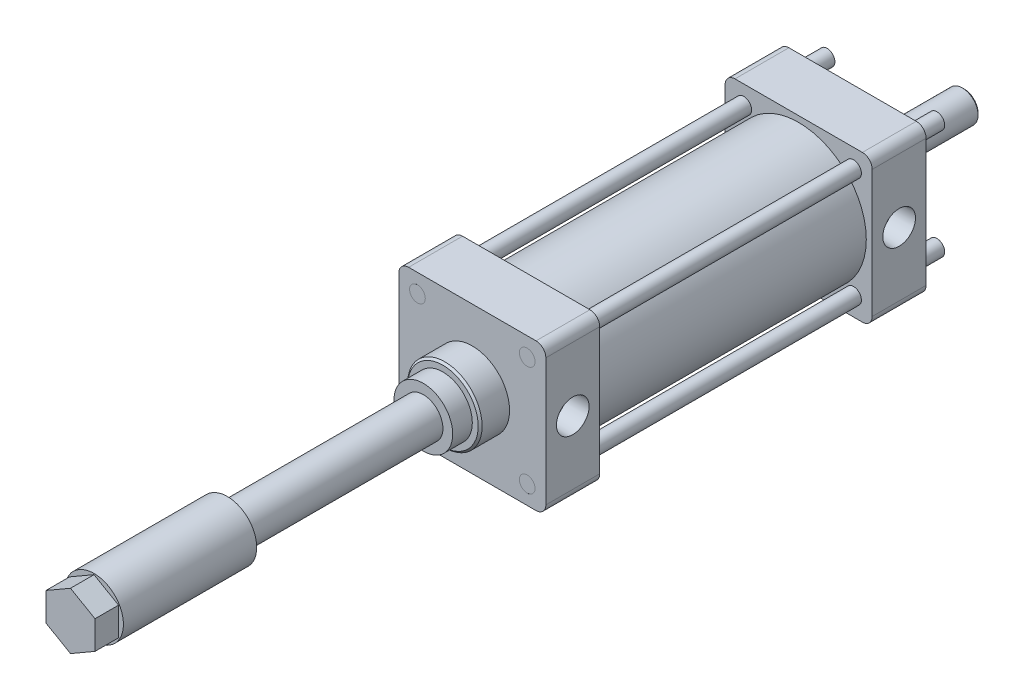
SolidWorks part; units mm, degrees
ref_plane "前视基准面" through (0, 0, 0) normal (0, 0, 1) x (1, 0, 0)
ref_plane "上视基准面" through (0, 0, 0) normal (0, 1, 0) x (1, 0, 0)
ref_plane "右视基准面" through (0, 0, 0) normal (1, 0, 0) x (0, 0, -1)
sketch "草图1" plane through (0, 0, 0) normal (0, 0, 1) x (1, 0, 0)
  line L0 (0, 0) -> (28, 0) construction
  line L1 (32.5, 37.5) -> (-32.5, 37.5)
  line L2 (37.5, 32.5) -> (37.5, -32.5)
  line L3 (32.5, -37.5) -> (-32.5, -37.5)
  line L4 (-37.5, 32.5) -> (-37.5, -32.5)
  line L5 (37.5, 37.5) -> (-37.5, -37.5) construction
  line L6 (37.5, -37.5) -> (-37.5, 37.5) construction
  line L7 (28, 0) -> (28, -28) construction
  arc A0 (-37.5, -32.5) -> (-32.5, -37.5) centre (-32.5, -32.5) ccw
  arc A1 (37.5, -32.5) -> (32.5, -37.5) centre (32.5, -32.5) cw
  arc A2 (32.5, 37.5) -> (37.5, 32.5) centre (32.5, 32.5) cw
  arc A3 (-37.5, 32.5) -> (-32.5, 37.5) centre (-32.5, 32.5) cw
  circle A4 centre (28, -28) radius 4
  circle A5 centre (-28, -28) radius 4
  circle A6 centre (-28, 28) radius 4
  circle A7 centre (28, 28) radius 4
  point P0 (0, 0)
  point P31 (0, 0)
  dimension "D3" = 5
  dimension "D4" = 4
  dimension "D1" = 75
  dimension "D2" = 75
extrude "凸台-拉伸1" add sketch "草图1" along normal blind 27.5
sketch "草图2" plane through (0, 0, 0) normal (0, 0, -1) x (-1, 0, 0)
  circle A0 centre (0, 0) radius 19
extrude "凸台-拉伸2" add sketch "草图2" along normal blind 15
sketch "草图3" plane through (0, 0, -15) normal (0, 0, -1) x (-1, 0, 0)
  circle A0 centre (0, 0) radius 10
extrude "凸台-拉伸3" add sketch "草图3" along normal blind 10
sketch "草图4" plane through (0, 0, -25) normal (0, 0, -1) x (-1, 0, 0)
  circle A0 centre (0, 0) radius 8
extrude "凸台-拉伸4" add sketch "草图4" along normal blind 32
chamfer "倒角1" distance 1 angle 45 3 edges at (-8, 0, -57) (-19, 0, -15) (-10, 0, -25)
sketch "草图5" plane through (0, 0, 27.5) normal (0, 0, 1) x (1, 0, 0)
  circle A0 centre (0, 0) radius 34.5
extrude "凸台-拉伸5" add sketch "草图5" along normal blind 139
sketch "草图6" plane through (0, 0, 166.5) normal (0, 0, 1) x (1, 0, 0)
  line L0 (-37.5, 32.5) -> (-37.5, -32.5) construction
  line L1 (-32.5, -37.5) -> (32.5, -37.5) construction
  line L2 (32.5, 37.5) -> (-32.5, 37.5) construction
  line L3 (37.5, -32.5) -> (37.5, 32.5) construction
  line L4 (-37.5, 32.5) -> (-37.5, -32.5)
  line L5 (-32.5, -37.5) -> (32.5, -37.5)
  line L6 (32.5, 37.5) -> (-32.5, 37.5)
  line L7 (37.5, -32.5) -> (37.5, 32.5)
  circle A0 centre (-28, 28) radius 4 construction
  arc A1 (-32.5, 37.5) -> (-37.5, 32.5) centre (-32.5, 32.5) ccw construction
  circle A2 centre (-28, -28) radius 4 construction
  arc A3 (-37.5, -32.5) -> (-32.5, -37.5) centre (-32.5, -32.5) ccw construction
  arc A4 (32.5, -37.5) -> (37.5, -32.5) centre (32.5, -32.5) ccw construction
  circle A5 centre (28, -28) radius 4 construction
  circle A6 centre (28, 28) radius 4 construction
  arc A7 (37.5, 32.5) -> (32.5, 37.5) centre (32.5, 32.5) ccw construction
  circle A8 centre (-28, 28) radius 4
  arc A9 (-32.5, 37.5) -> (-37.5, 32.5) centre (-32.5, 32.5) ccw
  circle A10 centre (-28, -28) radius 4
  arc A11 (-37.5, -32.5) -> (-32.5, -37.5) centre (-32.5, -32.5) ccw
  arc A12 (32.5, -37.5) -> (37.5, -32.5) centre (32.5, -32.5) ccw
  circle A13 centre (28, -28) radius 4
  circle A14 centre (28, 28) radius 4
  arc A15 (37.5, 32.5) -> (32.5, 37.5) centre (32.5, 32.5) ccw
extrude "凸台-拉伸6" add sketch "草图6" along normal blind 27.5
sketch "草图7" plane through (0, 0, 194) normal (0, 0, 1) x (1, 0, 0)
  circle A0 centre (0, 0) radius 19
extrude "凸台-拉伸7" add sketch "草图7" along normal blind 15
chamfer "倒角2" distance 1 angle 45 1 edges at (19, 0, 209)
sketch "草图8" plane through (0, 0, 209) normal (0, 0, 1) x (1, 0, 0)
  circle A0 centre (0, 0) radius 15
extrude "凸台-拉伸8" add sketch "草图8" along normal blind 10
sketch "草图9" plane through (0, 0, 219) normal (0, 0, 1) x (1, 0, 0)
  circle A0 centre (0, 0) radius 10
extrude "凸台-拉伸9" add sketch "草图9" along normal blind 100
sketch "草图10" plane through (0, 0, 319) normal (0, 0, 1) x (1, 0, 0)
  circle A0 centre (0, 0) radius 15
extrude "凸台-拉伸10" add sketch "草图10" along normal blind 68
sketch "草图11" plane through (0, 0, 387) normal (0, 0, 1) x (1, 0, 0)
  line L1 (0, -14.4338) -> (12.5, -7.2169)
  line L2 (12.5, -7.2169) -> (12.5, 7.2169)
  line L3 (12.5, 7.2169) -> (0, 14.4338)
  line L4 (0, 14.4338) -> (-12.5, 7.2169)
  line L5 (-12.5, 7.2169) -> (-12.5, -7.2169)
  line L6 (-12.5, -7.2169) -> (0, -14.4338)
  circle A0 centre (0, 0) radius 12.5 construction
extrude "凸台-拉伸11" add sketch "草图11" along normal blind 12
sketch "草图12" plane through (0, 0, 0) normal (0, 0, -1) x (-1, 0, 0)
  circle A0 centre (-28, 28) radius 4 construction
  circle A1 centre (28, 28) radius 4 construction
  circle A2 centre (28, -28) radius 4 construction
  circle A3 centre (-28, -28) radius 4 construction
  circle A4 centre (-28, 28) radius 4
  circle A5 centre (28, 28) radius 4
  circle A6 centre (28, -28) radius 4
  circle A7 centre (-28, -28) radius 4
extrude "凸台-拉伸12" add sketch "草图12" along normal blind 15 and the other way up to surface (194 mm away) separate body
hole_wizard "3/8 Rc 螺纹孔1" positions "草图13" profile "草图14" size "3/8" standard "ISO"
sketch "草图13" plane through (37.5, 0, 0) normal (1, 0, 0) x (0, 0, -1)
  line L1 (-166.5, -34.5) -> (-166.5, 34.5) construction
  line L2 (-27.5, -32.5) -> (-27.5, 32.5) construction
  point P0 (-13.75, 0)
  point P2 (-180.25, 0)
  dimension "D1" = 13.75
  dimension "D2" = 13.75
sketch "草图14" plane through (37.5, 0, 13.75) normal (0, 1, 0) x (0, 0, -1)
  line L0 (0, 0) -> (0, 22.3862)
  line L1 (7.15, 18.09) -> (0, 22.3862)
  line L2 (-7.15, 18.09) -> (0, 22.3862) construction
  line L3 (7.15, 18.09) -> (7.15, 11.4)
  line L4 (7.15, 11.4) -> (7.9751, 11.4)
  line L5 (7.9751, 11.4) -> (8.331, 0)
  line L6 (-7.9751, 11.4) -> (-8.331, 0) construction
  line L7 (8.331, 0) -> (0, 0)
  line L8 (0, -6.35) -> (0, 107.95) construction
  line L11 (-7.15, 11.4) -> (-7.9751, 11.4) construction
  dimension "螺纹孔钻头直径" = 14.3
  dimension "螺纹孔钻头深度" = 18.09
  dimension "螺纹直径" = 16.662
  dimension "螺纹角度" = 3.576
  dimension "螺纹深度" = 11.4
  dimension "导头角度" = 118
